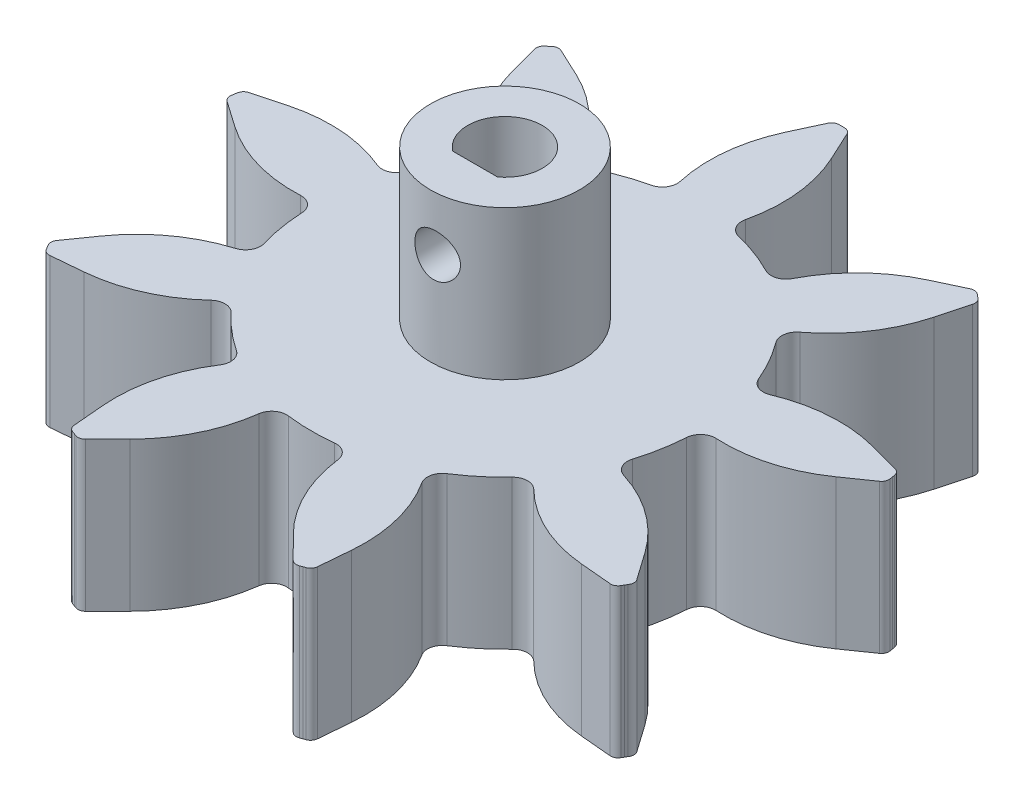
SolidWorks part; units mm, degrees
ref_plane "Front Plane" through (0, 0, 0) normal (0, 0, 1) x (1, 0, 0)
ref_plane "Top Plane" through (0, 0, 0) normal (0, 1, 0) x (1, 0, 0)
ref_plane "Right Plane" through (0, 0, 0) normal (1, 0, 0) x (0, 0, -1)
sketch "Sketch1" plane through (0, 0, 0) normal (0, 1, 0) x (1, 0, 0)
  line L0 (0.6385, 26.0068) -> (0.8199, 26.0066)
  line L1 (2.1647, 23.7966) -> (1.2727, 25.7172)
  line L2 (0.6385, 26.0068) -> (0.4571, 26.0066)
  line L3 (-0.8878, 23.7966) -> (0.0043, 25.7172)
  line L4 (2.046, 1.5067) -> (-0.954, 1.5067)
  line L20 (-13.8459, 20.8022) -> (-13.7068, 20.9186)
  line L21 (-11.2561, 20.0902) -> (-13.1739, 20.988)
  line L22 (-13.8459, 20.8022) -> (-13.9847, 20.6854)
  line L23 (-13.5944, 18.128) -> (-14.1456, 20.1727)
  line L24 (-19.1545, 8.6241) -> (-21.2008, 8.0791)
  line L25 (-19.6846, 5.618) -> (-21.4211, 6.83)
  line L26 (-18.9858, -7.6633) -> (-19.0763, -7.5061)
  line L27 (-17.8349, -5.2364) -> (-19.0521, -6.9692)
  line L28 (-18.9858, -7.6633) -> (-18.8949, -7.8202)
  line L29 (-16.3086, -7.8799) -> (-18.4179, -8.0677)
  line L30 (-7.2363, -17.6048) -> (-7.4067, -17.5426)
  line L31 (-7.9146, -15.0059) -> (-7.7332, -17.1157)
  line L32 (-7.2363, -17.6048) -> (-7.0658, -17.6666)
  line L33 (-5.0462, -16.0499) -> (-6.5413, -17.5496)
  line L34 (8.1547, -17.668) -> (7.9841, -17.7299)
  line L35 (5.9645, -16.1132) -> (7.4596, -17.6128)
  line L36 (8.1547, -17.668) -> (8.325, -17.6058)
  line L37 (8.833, -15.0691) -> (8.6516, -17.179)
  line L38 (20.012, -7.9395) -> (19.9211, -8.0965)
  line L39 (17.3348, -8.1562) -> (19.444, -8.344)
  line L40 (20.012, -7.9395) -> (20.1024, -7.7823)
  line L41 (18.8345, -5.3965) -> (20.0518, -7.1293)
  line L42 (22.7203, 7.3228) -> (22.7516, 7.1441)
  line L43 (20.8088, 5.4359) -> (22.5453, 6.6479)
  line L44 (22.7203, 7.3228) -> (22.6886, 7.5014)
  line L45 (20.2787, 8.4421) -> (22.325, 7.8971)
  line L46 (14.8281, 18.0092) -> (15.3793, 20.0539)
  line L47 (12.4898, 19.9713) -> (14.4076, 20.8692)
  line L48 (-21.5644, 7.6834) -> (-21.6274, 7.3262)
  line L49 (14.9405, 20.7998) -> (15.2184, 20.5666)
  arc A0 (-9.8044, 11.3723) -> (-11.3752, 8.6916) centre (0.546, 3.5067) ccw
  arc A1 (2.8411, 17.3436) -> (2.1647, 23.7966) centre (-6.9047, 19.5842) ccw
  arc A2 (1.2727, 25.7172) -> (0.8199, 26.0066) centre (0.8192, 25.5066) ccw
  arc A3 (0.4571, 26.0066) -> (0.0043, 25.7172) centre (0.4577, 25.5066) ccw
  arc A4 (-0.8878, 23.7966) -> (-1.5726, 17.3809) centre (8.1817, 19.5842) ccw
  arc A6 (2.046, 1.5067) -> (-0.954, 1.5067) centre (0.546, 3.5067) ccw
  arc A50 (-13.1739, 20.988) -> (-13.7068, 20.9186) centre (-13.3859, 20.5352) ccw
  arc A51 (-6.5901, 15.5816) -> (-11.2561, 20.0902) centre (-15.4959, 11.0335) ccw
  arc A52 (-13.9847, 20.6854) -> (-14.1456, 20.1727) centre (-13.6628, 20.3028) ccw
  arc A53 (-13.5944, 18.128) -> (-9.995, 12.7731) centre (-3.9391, 20.7308) ccw
  arc A54 (-21.2008, 8.0791) -> (-21.5644, 7.6834) centre (-21.0721, 7.596) ccw
  arc A55 (-12.6821, 8.1696) -> (-19.1545, 8.6241) centre (-16.5809, -1.039) ccw
  arc A56 (-21.6274, 7.3262) -> (-21.4211, 6.83) centre (-21.1349, 7.24) ccw
  arc A57 (-19.6846, 5.618) -> (-13.4852, 3.8295) centre (-13.9612, 13.8182) ccw
  arc A58 (-19.0521, -6.9692) -> (-19.0763, -7.5061) centre (-18.643, -7.2566) ccw
  arc A59 (-12.5846, -1.4242) -> (-17.8349, -5.2364) centre (-9.652, -10.9845) ccw
  arc A60 (-18.8949, -7.8202) -> (-18.4179, -8.0677) centre (-18.4622, -7.5697) ccw
  arc A61 (-16.3086, -7.8799) -> (-10.41, -5.2651) centre (-17.1952, 2.0807) ccw
  arc A62 (-7.7332, -17.1157) -> (-7.4067, -17.5426) centre (-7.235, -17.0729) ccw
  arc A63 (-6.3431, -8.7108) -> (-7.9146, -15.0059) centre (2.0487, -14.1494) ccw
  arc A64 (-7.0658, -17.6666) -> (-6.5413, -17.5496) centre (-6.8954, -17.1966) ccw
  arc A65 (-5.0462, -16.0499) -> (-2.2083, -10.2553) centre (-12.1279, -8.9896) ccw
  arc A66 (7.4596, -17.6128) -> (7.9841, -17.7299) centre (7.8137, -17.2598) ccw
  arc A67 (3.1219, -10.2806) -> (5.9645, -16.1132) centre (13.0463, -9.0528) ccw
  arc A68 (8.325, -17.6058) -> (8.6516, -17.179) centre (8.1534, -17.1362) ccw
  arc A69 (8.833, -15.0691) -> (7.2821, -8.8061) centre (-1.1303, -14.2126) ccw
  arc A70 (19.444, -8.344) -> (19.9211, -8.0965) centre (19.4884, -7.846) ccw
  arc A71 (11.3817, -5.3993) -> (17.3348, -8.1562) centre (18.1949, 1.5067) ccw
  arc A72 (20.1024, -7.7823) -> (20.0518, -7.1293) centre (19.7004, -7.4851) ccw
  arc A73 (18.8345, -5.3965) -> (13.6207, -1.5956) centre (10.6517, -11.1446) ccw
  arc A74 (22.5453, 6.6479) -> (22.7516, 7.1441) centre (22.2591, 7.0579) ccw
  arc A75 (14.5713, 3.6493) -> (20.8088, 5.4359) centre (15.0854, 13.6361) ccw
  arc A76 (22.6886, 7.5014) -> (22.325, 7.8971) centre (22.1963, 7.4139) ccw
  arc A77 (20.2787, 8.4421) -> (13.8415, 8.0024) centre (17.7051, -1.2211) ccw
  arc A78 (15.3793, 20.0539) -> (15.2184, 20.5666) centre (14.8965, 20.184) ccw
  arc A79 (11.1983, 12.6312) -> (14.8281, 18.0092) centre (5.1728, 20.612) ccw
  arc A80 (14.9405, 20.7998) -> (14.4076, 20.8692) centre (14.6196, 20.4164) ccw
  arc A81 (12.4898, 19.9713) -> (7.8412, 15.4968) centre (16.7297, 10.9147) ccw
  arc A82 (2.8411, 17.3436) -> (3.5821, 16.1472) centre (3.8156, 17.1196) ccw
  arc A83 (-2.327, 16.1853) -> (-1.5726, 17.3809) centre (-2.548, 17.1606) ccw
  arc A84 (-6.5901, 15.5816) -> (-5.2534, 15.1415) centre (-5.6995, 16.0364) ccw
  arc A85 (-9.8044, 11.3723) -> (-9.995, 12.7731) centre (-10.6006, 11.9774) ccw
  arc A86 (-12.6821, 8.1696) -> (-11.3752, 8.6916) centre (-12.2922, 9.0905) ccw
  arc A87 (-12.4388, 2.8789) -> (-13.4852, 3.8295) centre (-13.4376, 2.8306) ccw
  arc A88 (-12.5846, -1.4242) -> (-11.919, -0.1842) centre (-12.8778, -0.4682) ccw
  arc A89 (-8.9974, -5.3207) -> (-10.41, -5.2651) centre (-9.7315, -5.9997) ccw
  arc A90 (-6.3431, -8.7108) -> (-6.6302, -7.3331) centre (-7.1822, -8.1669) ccw
  arc A91 (-1.0905, -9.3898) -> (-2.2083, -10.2553) centre (-1.2164, -10.3819) ccw
  arc A92 (3.1219, -10.2806) -> (2.0164, -9.4098) centre (2.1295, -10.4034) ccw
  arc A93 (7.5821, -7.4246) -> (7.2821, -8.8061) centre (8.1234, -8.2654) ccw
  arc A94 (11.3817, -5.3993) -> (9.975, -5.4428) centre (10.7003, -6.1312) ccw
  arc A95 (12.9625, -0.3444) -> (13.6207, -1.5956) centre (13.9176, -0.6407) ccw
  arc A96 (14.5713, 3.6493) -> (13.5217, 2.7118) centre (14.5198, 2.6507) ccw
  arc A97 (12.5331, 8.5377) -> (13.8415, 8.0024) centre (13.4552, 8.9247) ccw
  arc A98 (11.1983, 12.6312) -> (10.997, 11.2384) centre (11.8009, 11.8331) ccw
  arc A99 (6.4948, 15.0658) -> (7.8412, 15.4968) centre (6.9524, 15.955) ccw
  arc A121 (-12.4388, 2.8789) -> (-11.919, -0.1842) centre (0.546, 3.5067) ccw
  arc A122 (-8.9974, -5.3207) -> (-6.6302, -7.3331) centre (0.546, 3.5067) ccw
  arc A123 (-1.0905, -9.3898) -> (2.0164, -9.4098) centre (0.546, 3.5067) ccw
  arc A124 (7.5821, -7.4246) -> (9.975, -5.4428) centre (0.546, 3.5067) ccw
  arc A125 (12.9625, -0.3444) -> (13.5217, 2.7118) centre (0.546, 3.5067) ccw
  arc A126 (12.5331, 8.5377) -> (10.997, 11.2384) centre (0.546, 3.5067) ccw
  arc A127 (6.4948, 15.0658) -> (3.5821, 16.1472) centre (0.546, 3.5067) ccw
  arc A128 (-2.327, 16.1853) -> (-5.2534, 15.1415) centre (0.546, 3.5067) ccw
  point P0 (5.0709, 15.6939)
  dimension "D2" = 5
  dimension "D1" = 12.1871
  dimension "D3" = 2
extrude "Boss-Extrude1" add sketch "Sketch1" along normal blind 10
sketch "Sketch2" plane through (0, 10, 0) normal (0, 1, 0) x (1, 0, 0)
  line L2 (-0.954, 1.5067) -> (2.046, 1.5067)
  circle A1 centre (0.546, 3.5067) radius 5
  arc A3 (2.046, 1.5067) -> (-0.954, 1.5067) centre (0.546, 3.5067) ccw
  dimension "D2" = 5
  dimension "D1" = 10
  dimension "D3" = 2
sketch "Sketch4" plane through (0, 0, 0) normal (0, 0, 1) x (1, 0, 0)
  circle A0 centre (0.8089, 16.3358) radius 1.45
  dimension "D1" = 2.9
extrude "Boss-Extrude3" add sketch "Sketch2" along normal blind 10
extrude "Cut-Extrude1" cut sketch "Sketch4" along normal blind 5 and the other way blind 2
